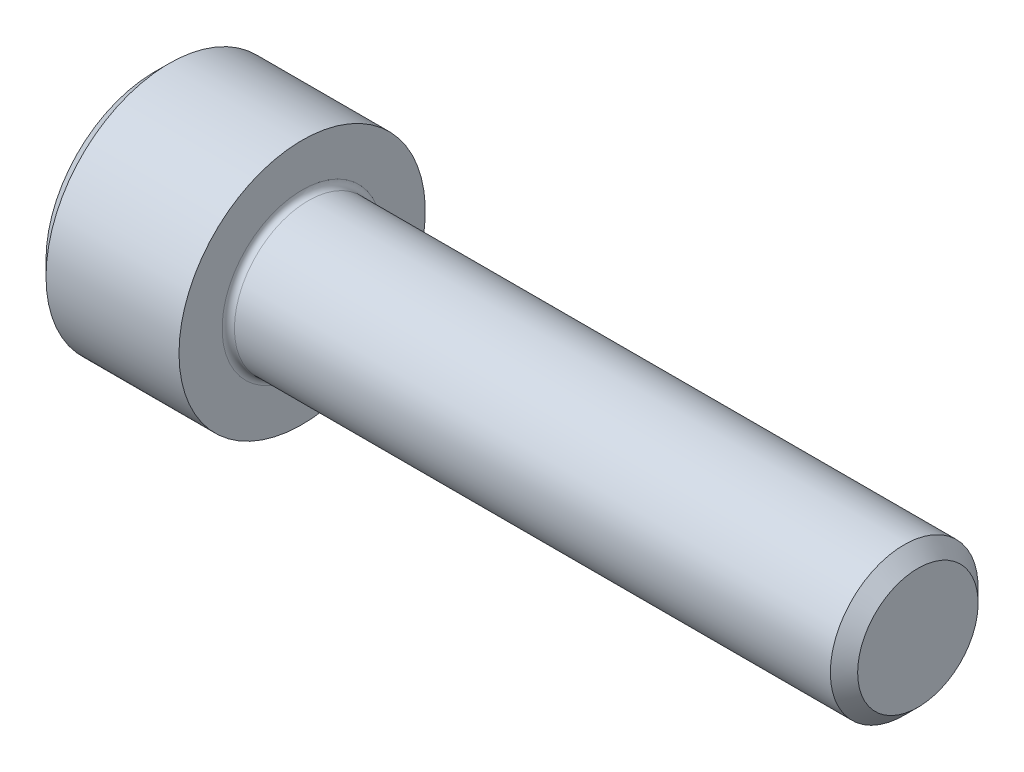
SolidWorks part; units mm, degrees
ref_plane "Plane1" through (0, 0, 0) normal (0, 0, 1) x (1, 0, 0)
ref_plane "Plane2" through (0, 0, 0) normal (0, 1, 0) x (1, 0, 0)
ref_plane "Plane3" through (0, 0, 0) normal (1, 0, 0) x (0, 0, -1)
sketch "BodySke" plane through (0, 0, 0) normal (0, 0, 1) x (1, 0, 0)
  line L0 (0, 0) -> (0, 4.4)
  line L1 (0.6, 5) -> (6, 5)
  line L2 (6, 5) -> (6, 3)
  line L3 (6, 3) -> (30.4455, 3)
  line L4 (31, 2.4455) -> (31, 0)
  line L5 (31, 0) -> (0, 0)
  line L6 (-31.75, 0) -> (127, 0) construction
  line L7 (0, 4.4) -> (0.6, 5)
  line L8 (31, 2.4455) -> (30.4455, 3)
  line L9 (0, -4.4) -> (0.6, -5) construction
  line L10 (31, -2.4455) -> (30.4455, -3) construction
  line L11 (7, 9.525) -> (7, 3.175) construction
  line L12 (6, 9.525) -> (6, 3.175) construction
  line L13 (-19, 9.525) -> (-19, 3.175) construction
  dimension "Diameter" = 6
  dimension "Head_ht" = 6
  dimension "Length" = 25
  dimension "Body_ch_ang" = 45
  dimension "Head_dia" = 10
  dimension "Head_ch_ang" = 45
  dimension "Minor_dia" = 4.891
  dimension "Advance" = 1
  dimension "Thread_nom" = 25
  dimension "Thread_length" = 50
  dimension "Head_ch_ht" = 0.6
revolve "Base-Revolve" add sketch "BodySke"
fillet "Fillet1" radius 0.25 1 edges at (6, 0, 3)
sketch "Sketch2" plane through (0, 0, 0) normal (0, 0, 1) x (1, 0, 0)
  line L0 (0, 2.542) -> (3, 2.542)
  line L1 (3, 2.542) -> (4.4676, 0)
  line L2 (-31.75, 0) -> (127, 0) construction
  line L3 (4.4676, 0) -> (0, 0)
  line L4 (0, 0) -> (0, 2.542)
  line L5 (0, 4.4) -> (0, -4.4) construction
  line L6 (0, 0) -> (47.625, 0) construction
  line L7 (6, -5) -> (6, 5) construction
  dimension "D1" = 2.542
  dimension "D2" = 60
  dimension "Wall_thickness" = 3
revolve "Hex-PreBroach" cut sketch "Sketch2" angle 360 about L6
sketch "Sketch3" plane through (0, 0, 0) normal (-1, 0, 0) x (0, 0.5, 0.866)
  line L0 (1.4676, 2.542) -> (-1.4676, 2.542)
  line L1 (-1.4676, 2.542) -> (-2.9352, 0)
  line L2 (1.4676, 2.542) -> (2.9352, 0)
  line L3 (1.4676, -2.542) -> (2.9352, 0)
  line L4 (1.4676, -2.542) -> (-1.4676, -2.542)
  line L5 (-1.4676, -2.542) -> (-2.9352, 0)
  dimension "D1" = 2.542
  dimension "D2" = 2.542
  dimension "Hex_size" = 5.084
extrude "Hex" cut sketch "Sketch3" against normal blind 3
sketch "Sketch4" plane through (0, 0, 0) normal (-1, 0, 0) x (0, 0, 1)
  line L0 (0, 0) -> (2.8067, 0)
  line L1 (0, 0) -> (6.1484, 3.5498) construction
  line L2 (0, 0) -> (1.4033, 2.4307)
  line L3 (2.3336, 0.614) -> (2.6851, 0.817)
  line L4 (1.6986, 1.7139) -> (2.0501, 1.9169)
  arc A0 (2.3336, 0.614) -> (1.6986, 1.7139) centre (0, 0) ccw
  arc A1 (2.8067, 0) -> (2.6851, 0.817) centre (0, 0) ccw
  arc A2 (1.4033, 2.4307) -> (2.0501, 1.9169) centre (0, 0) cw
  dimension "D1" = 30
  dimension "Spline_n_dim" = 4.826
  dimension "Spline_m_dim" = 5.6134
  dimension "D2" = 60
  dimension "D3" = 0.635
  dimension "Spline_p_dim" = 1.27
extrude "Spline" [suppressed] cut sketch "Sketch4" against normal blind 3
pattern_circular "CirPattern1" [suppressed] count 6 every 60
sketch "Sketch5" plane through (0, 0, 0) normal (0, 0, 1) x (1, 0, 0)
  line L0 (-31.75, 0) -> (127, 0) construction
  line L2 (0, 4.4) -> (0, -4.4) construction
  circle A0 centre (2.3, 0) radius 0.675
  dimension "Drilled_hole_dia" = 1.35
  dimension "Drilled_hole_loc" = 2.3
extrude "Hole" [suppressed] cut sketch "Sketch5" against normal through all and the other way through all
pattern_circular "Drilled-4" [suppressed] count 2 every 60
pattern_circular "Drilled-6" [suppressed] count 3 every 60
sketch "ThdSchSke" plane through (0, 0, 0) normal (0, 0, 1) x (1, 0, 0)
  line L0 (7, -2.4455) -> (6.6117, -3)
  line L1 (7, -2.4455) -> (7.3883, -3)
  line L2 (7.3883, -3) -> (7.3883, -3.75)
  line L3 (-3.175, 0) -> (5.1513, 0) construction
  line L5 (7.3883, -3.75) -> (6.6117, -3.75)
  line L6 (6.6117, -3.75) -> (6.6117, -3)
  line L7 (0, 4.4) -> (0, -4.4) construction
  dimension "Thread_minor" = 4.891
  dimension "Diameter" = 6
  dimension "Start" = 7
  dimension "SideAngle" = 55
  dimension "VeeAngle" = 70
  dimension "Overcut" = 7.5
revolve "ThreadSchematic" [suppressed] cut sketch "ThdSchSke" angle 360 about L3
pattern_linear "ThdSchPat" [suppressed]
equation "\"D2@Sketch3\" = \"Hex_size@Sketch3\" / 2"
equation "\"D1@Sketch3\" = \"Hex_size@Sketch3\" / 2"
equation "\"D1@Sketch2\" = \"Hex_size@Sketch3\" / 2"
equation "\"D3@Sketch4\" = \"Spline_p_dim@Sketch4\" / 2"
equation "\"Thread_minor@ThreadCosmetic\"  =  \"Minor_dia@BodySke\""
equation "\"D2@CirPattern1\" = 360 / \"Num_teeth@CirPattern1\""
equation "\"Wall_thickness@Sketch2\" = \"Head_ht@BodySke\" - \"Key_eng@Hex\""
equation "\"Thread_length@ThreadCosmetic\" = ((sgn( (\"Length@BodySke\" - \"Advance@BodySke\" ) - \"Thread_nom@BodySke\" )-1)*( (\"Length@BodySke\" - \"Advance@BodySke\" ) - \"Thread_nom@BodySke\" ))/-2+ \"Thread_nom@BodySke\""
equation "\"Thread_minor@ThdSchSke\" = \"Minor_dia@BodySke\""
equation "\"Diameter@ThdSchSke\" = \"Diameter@BodySke\""
equation "\"Overcut@ThdSchSke\" = \"Diameter@BodySke\" * 1.25"
equation "\"Start@ThdSchSke\" = \"Head_ht@BodySke\" + \"Length@BodySke\" - \"Thread_length@ThreadCosmetic\"  '---Non-countersunk---"
equation "\"Num_threads@ThdSchPat\" = int( \"Thread_length@ThreadCosmetic\" / \"Advance@BodySke\" + 0.999 )  + 1"
equation "\"Advance@ThdSchPat\" = \"Thread_length@ThreadCosmetic\" /  (\"Num_threads@ThdSchPat\" - 1) 'relax it"
equation "\"Num_threads@ThdSchPat\" = \"Num_threads@ThdSchPat\" - sgn( \"Num_threads@ThdSchPat\" - 1) '---chamfered tips only---"
